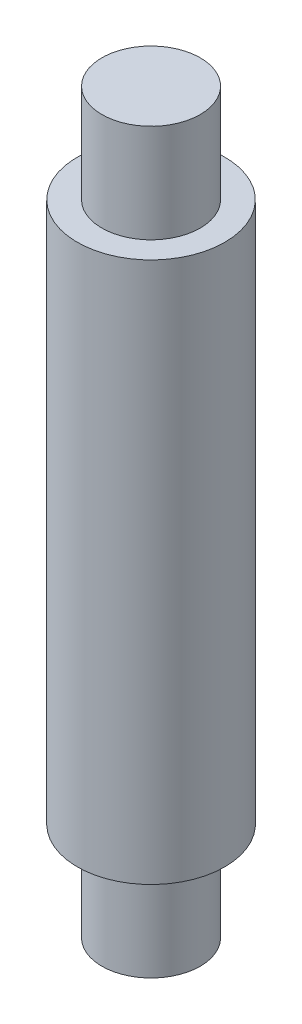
SolidWorks part; units mm, degrees
ref_plane "Front" through (0, 0, 0) normal (0, 0, 1) x (1, 0, 0)
ref_plane "Top" through (0, 0, 0) normal (0, 1, 0) x (1, 0, 0)
ref_plane "Right" through (0, 0, 0) normal (1, 0, 0) x (0, 0, -1)
sketch "Sketch1" plane through (0, 0, 0) normal (0, 0, 1) x (1, 0, 0)
  line L0 (-75, 0) -> (-75, 207.5777) construction
  line L3 (-75, 0) -> (-65, 0)
  line L4 (-65, 0) -> (-65, 20)
  line L6 (-65, 20) -> (-60, 20)
  line L8 (-60, 20) -> (-60, 130)
  line L9 (-60, 130) -> (-65, 130)
  line L10 (-65, 130) -> (-65, 150)
  line L11 (-65, 150) -> (-75, 150)
  line L12 (-75, 150) -> (-75, 0)
  dimension "D2" = 20
  dimension "D3" = 30
  dimension "D4" = 150
revolve "Revolve1" add sketch "Sketch1" angle 360 about L0
